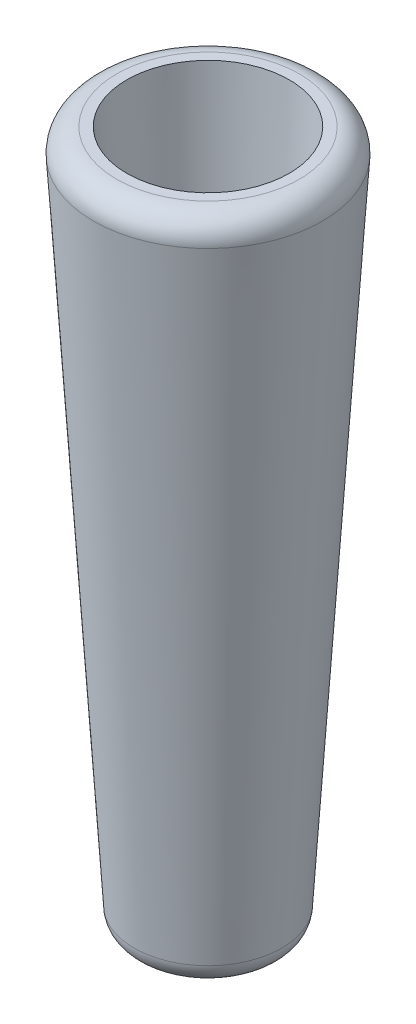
SolidWorks part; units mm, degrees
ref_plane "Front Plane" through (0, 0, 0) normal (0, 0, 1) x (1, 0, 0)
ref_plane "Top Plane" through (0, 0, 0) normal (0, 1, 0) x (1, 0, 0)
ref_plane "Right Plane" through (0, 0, 0) normal (1, 0, 0) x (0, 0, -1)
sketch "Sketch1" plane through (0, 0, 0) normal (0, 0, 1) x (1, 0, 0)
  line L0 (0, 0) -> (5, 0)
  line L1 (5, 0) -> (2.5, -40)
  line L2 (2.5, -40) -> (0, -40)
  line L3 (0, -40) -> (0, 0)
  dimension "D1" = 40
  dimension "D2" = 5
  dimension "D3" = 2.5
revolve "Revolve1" add sketch "Sketch1" angle 360 about L3
shell "Shell1" thickness 1.5
sketch "Sketch2" plane through (0, -40, 0) normal (0, -1, 0) x (1, 0, 0)
  circle A0 centre (0, 0) radius 25
  dimension "D1" = 50
extrude "Cut-Extrude1" cut sketch "Sketch2" against normal blind 10
fillet "Fillet1" radius 1 2 edges at (0, 0, -5) (0, -30, -3.125)
